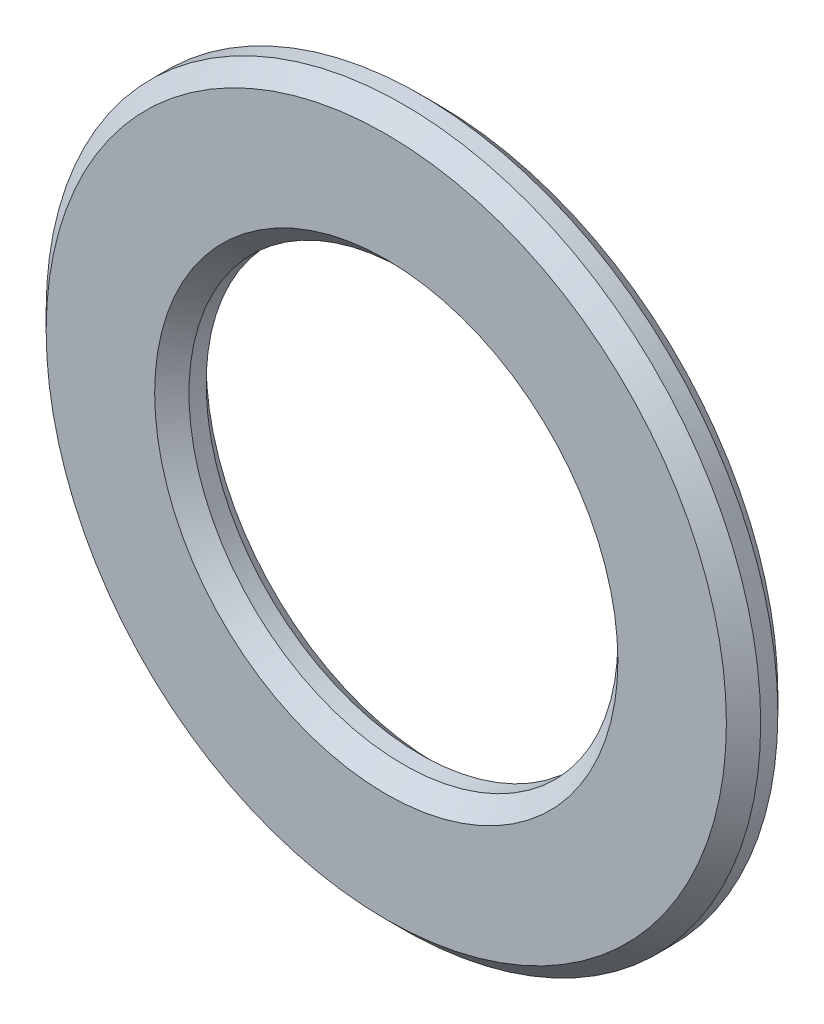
SolidWorks part; units mm, degrees
ref_plane "Front Plane" through (0, 0, 0) normal (0, 0, 1) x (1, 0, 0)
ref_plane "Top Plane" through (0, 0, 0) normal (0, 1, 0) x (1, 0, 0)
ref_plane "Right Plane" through (0, 0, 0) normal (1, 0, 0) x (0, 0, -1)
sketch "Sketch1" plane through (0, 0, 0) normal (0, 0, 1) x (1, 0, 0)
  circle A0 centre (0, 0) radius 12.5
  circle A1 centre (0, 0) radius 20.825
  dimension "D1" = 25
  dimension "D2" = 41.65
extrude "Extrude1" add sketch "Sketch1" along normal blind 3
chamfer "Chamfer1" distance 1 angle 45 4 edges at (12.5, 0, 0) (20.825, 0, 0) (12.5, 0, 3) (20.825, 0, 3)
